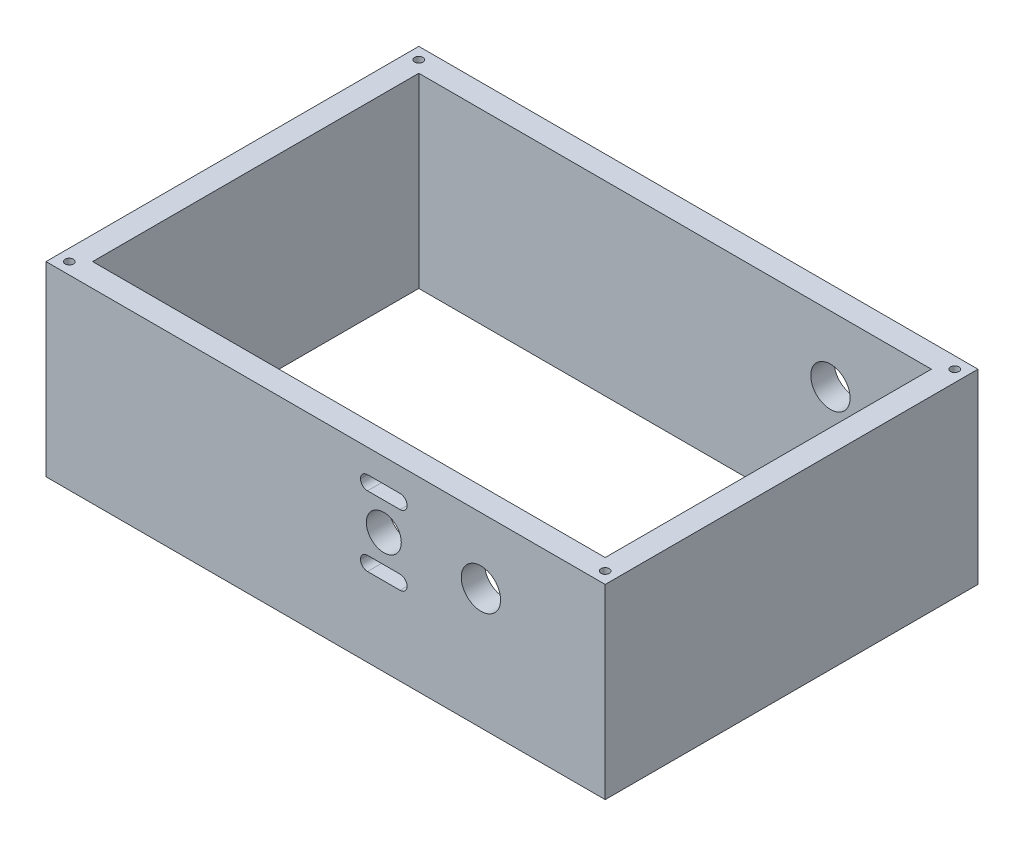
SolidWorks part; units mm, degrees
ref_plane "Front Plane" through (0, 0, 0) normal (0, 0, 1) x (1, 0, 0)
ref_plane "Top Plane" through (0, 0, 0) normal (0, 1, 0) x (1, 0, 0)
ref_plane "Right Plane" through (0, 0, 0) normal (1, 0, 0) x (0, 0, -1)
sketch "Sketch1" plane through (0, 0, 0) normal (0, 1, 0) x (1, 0, 0)
  line L0 (-69.85, 44.45) -> (69.85, 44.45)
  line L1 (-76.2, -50.8) -> (76.2, -50.8)
  line L2 (-76.2, -50.8) -> (-76.2, 50.8)
  line L3 (-76.2, 50.8) -> (76.2, 50.8)
  line L4 (76.2, -50.8) -> (76.2, 50.8)
  line L5 (-76.2, -50.8) -> (76.2, 50.8) construction
  line L6 (-76.2, 50.8) -> (76.2, -50.8) construction
  line L7 (69.85, -44.45) -> (69.85, 44.45)
  line L8 (-69.85, -44.45) -> (69.85, -44.45)
  line L9 (-69.85, -44.45) -> (-69.85, 44.45)
  point P0 (0, 0)
  dimension "D1" = 152.4
  dimension "D2" = 101.6
  dimension "D3" = 6.35
extrude "Extrude1" add sketch "Sketch1" along normal blind 50.8
sketch "Sketch4" plane through (0, 0, 50.8) normal (0, 0, 1) x (1, 0, 0)
  line L0 (76.2, 50.8) -> (76.2, 0) construction
  line L1 (-76.2, 50.8) -> (76.2, 50.8) construction
  circle A0 centre (42.3291, 32.893) radius 5.1308 construction
  dimension "D3" = 10.2616
  dimension "D1" = 33.8709
  dimension "D2" = 17.907
sketch "Sketch5" plane through (0, 0, 50.8) normal (0, 0, 1) x (1, 0, 0)
  line L0 (-76.2, 50.8) -> (76.2, 50.8) construction
  circle A0 centre (15.8623, 32.893) radius 4.7625
  dimension "D1" = 9.525
  dimension "D2" = 17.907
  dimension "D3" = 26.4668
extrude "Extrude4" cut sketch "Sketch5" against normal up to surface (6.35 mm away)
sketch "Sketch6" plane through (0, 50.8, 0) normal (0, 1, 0) x (-1, 0, 0)
  line L0 (-76.2, -50.8) -> (76.2, -50.8) construction
  line L1 (76.2, -50.8) -> (76.2, 50.8) construction
  point P0 (73.025, -47.625)
  dimension "D1" = 3.175
  dimension "D2" = 3.175
hole_wizard "#4-40 Tapped Hole1" positions "3DSketch1" profile "Sketch7" tap size "#4-40" standard "Ansi Inch"
sketch3d "3DSketch1"
  point P0 (-73.025, 50.8, -47.625)
sketch "Sketch7" plane through (-73.025, 50.8, -47.625) normal (1, 0, 0) x (0, 0, 1)
  line L0 (0, 0) -> (0, 19.7292)
  line L1 (0, 19.7292) -> (1.1303, 19.05)
  line L2 (1.1303, 19.05) -> (1.1303, 0)
  line L5 (1.1303, 0) -> (0, 0)
  line L10 (0, 19.7292) -> (-1.1303, 19.05) construction
  line L11 (0, -6.35) -> (0, 107.95) construction
  dimension "Tap Drill Dia." = 2.2606
  dimension "Tap Drill Depth" = 19.05
  dimension "Drill Angle" = 118
sketch "Sketch8" plane through (0, 0, 0) normal (0, -1, 0) x (1, 0, 0)
  line L0 (76.2, -50.8) -> (-76.2, -50.8) construction
  line L1 (-76.2, -50.8) -> (-76.2, 50.8) construction
  point P0 (-73.025, -47.625)
  dimension "D1" = 3.175
  dimension "D2" = 3.175
hole_wizard "#4-40 Tapped Hole2" positions "3DSketch2" profile "Sketch9" tap size "#4-40" standard "Ansi Inch"
sketch3d "3DSketch2"
  point P0 (-73.025, 0, -47.625)
sketch "Sketch9" plane through (-73.025, 0, -47.625) normal (1, 0, 0) x (0, 0, -1)
  line L0 (0, 0) -> (0, 19.7292)
  line L1 (0, 19.7292) -> (1.1303, 19.05)
  line L2 (1.1303, 19.05) -> (1.1303, 0)
  line L5 (1.1303, 0) -> (0, 0)
  line L10 (0, 19.7292) -> (-1.1303, 19.05) construction
  line L11 (0, -6.35) -> (0, 107.95) construction
  dimension "Tap Drill Dia." = 2.2606
  dimension "Tap Drill Depth" = 19.05
  dimension "Drill Angle" = 118
pattern_linear "LPattern1" count 2 spacing 146.05 along (1, 0, 0) count 2 spacing 95.25 along (0, 0, 1) of "#4-40 Tapped Hole1", "#4-40 Tapped Hole2"
sketch "Sketch10" plane through (0, 0, 50.8) normal (0, 0, 1) x (1, 0, 0)
  line L1 (22.2098, 44.323) -> (9.5098, 44.323)
  line L2 (22.2098, 44.323) -> (22.2098, 40.513)
  line L3 (22.2098, 40.513) -> (9.5098, 40.513)
  line L4 (9.5098, 44.323) -> (9.5098, 40.513)
  line L5 (22.2098, 44.323) -> (9.5098, 40.513) construction
  line L6 (22.2098, 40.513) -> (9.5098, 44.323) construction
  line L7 (15.8623, 37.6555) -> (15.8623, 28.1305) construction
  circle A0 centre (15.8623, 32.893) radius 4.7625 construction
  point P0 (15.8598, 42.418)
  dimension "D1" = 12.7
  dimension "D2" = 3.81
  dimension "D3" = 9.525
  dimension "D4" = 0.0025
extrude "Extrude5" cut sketch "Sketch10" against normal up to surface (6.35 mm away)
fillet "Fillet1" radius 1.905 4 edges at (22.2098, 40.513, 47.625) (22.2098, 44.323, 47.625) (9.5098, 44.323, 47.625) (9.5098, 40.513, 47.625)
pattern_linear "LPattern2" count 2 spacing 19.05 along (0, -1, 0) of "Fillet1", "Extrude5"
hole_wizard "1/2-13 Tapped Hole1" positions "3DSketch3" profile "Sketch11" tap size "1/2-13" standard "Ansi Inch"
sketch3d "3DSketch3"
  point P0 (42.3291, 32.893, 50.8)
sketch "Sketch11" plane through (42.3291, 32.893, 50.8) normal (1, 0, 0) x (0, -1, 0)
  line L0 (0, 0) -> (0, 101.6)
  line L1 (0, 101.6) -> (5.3581, 101.6)
  line L2 (5.3581, 101.6) -> (5.3581, 0)
  line L5 (5.3581, 0) -> (0, 0)
  line L11 (0, -6.35) -> (0, 107.95) construction
  dimension "Thru Tap Drill Dia." = 10.7163
  dimension "Thru Tap Drill Depth" = 101.6
